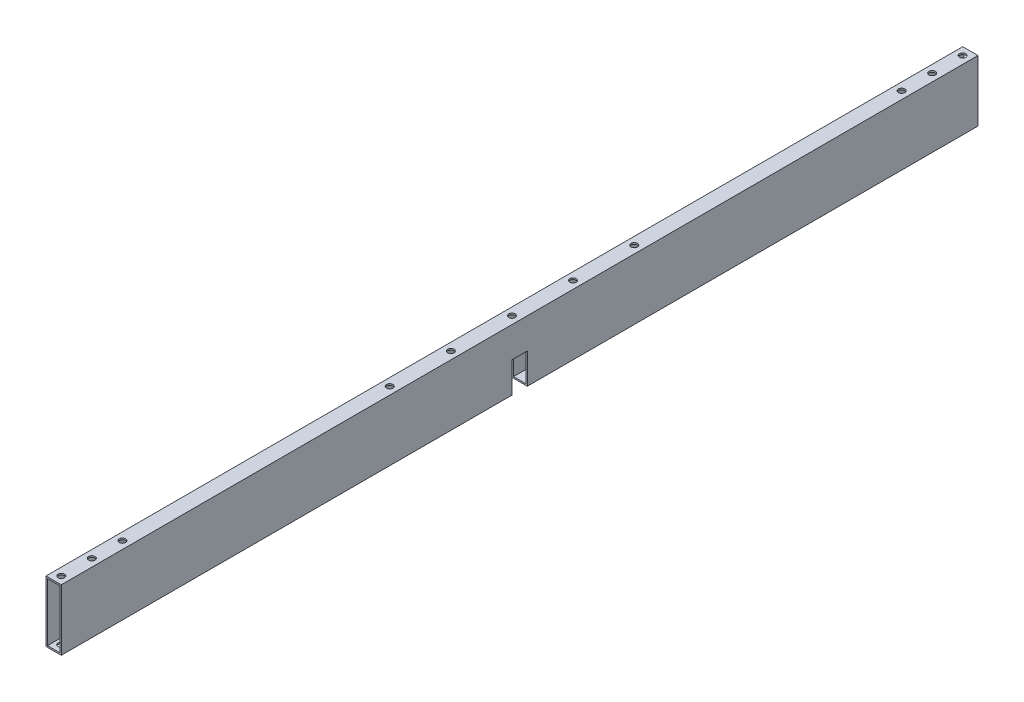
SolidWorks part; units mm, degrees
ref_plane "前视基准面" through (0, 0, 0) normal (0, 0, 1) x (1, 0, 0)
ref_plane "上视基准面" through (0, 0, 0) normal (0, 1, 0) x (1, 0, 0)
ref_plane "右视基准面" through (0, 0, 0) normal (1, 0, 0) x (0, 0, -1)
other "Configuration Table"
sketch "草图1" plane through (0, 0, 0) normal (0, 0, 1) x (1, 0, 0)
  line L1 (-4, -19) -> (4, -19)
  line L2 (-4, -19) -> (-4, 19)
  line L3 (-4, 19) -> (4, 19)
  line L4 (4, -19) -> (4, 19)
  line L5 (-4, -19) -> (4, 19) construction
  line L6 (-4, 19) -> (4, -19) construction
  line L7 (-5, -20) -> (5, -20)
  line L8 (-5, -20) -> (-5, 20)
  line L9 (-5, 20) -> (5, 20)
  line L10 (5, -20) -> (5, 20)
  line L11 (-5, -20) -> (5, 20) construction
  line L12 (-5, 20) -> (5, -20) construction
  point P0 (0, 0)
  point P6 (0, 0)
  dimension "D1" = 40
  dimension "D2" = 10
  dimension "D3" = 1
  dimension "D4" = 1
extrude "凸台-拉伸1" add sketch "草图1" along normal mid plane 600
sketch "草图2" plane through (0, 20, 0) normal (0, 1, 0) x (1, 0, 0)
  line L0 (0, 295) -> (0, 275) construction
  line L1 (5, -300) -> (5, 300) construction
  line L2 (5, 300) -> (-5, 300) construction
  circle A0 centre (0, 295) radius 2.1
  circle A1 centre (0, 275) radius 2.1
  circle A2 centre (0, 255) radius 2.1
  dimension "D5" = 4.2
  dimension "D2" = 20
  dimension "D3" = 5
  dimension "D4" = 5
  dimension "D1" = 3
extrude "切除-拉伸1" cut sketch "草图2" against normal through all
sketch "草图3" plane through (5, 0, 0) normal (1, 0, 0) x (0, 0, -1)
  line L0 (-300, -20) -> (300, -20) construction
  line L1 (-5, -20) -> (5, -20)
  line L2 (-5, -20) -> (-5, 0)
  line L3 (-5, 0) -> (5, 0)
  line L4 (5, -20) -> (5, 0)
  dimension "D1" = 10
  dimension "D2" = 5
extrude "切除-拉伸2" cut sketch "草图3" against normal through all
mirror "镜向1" about plane through (0, 0, 0) normal (0, 0, 1) of "切除-拉伸1"
sketch "草图4" plane through (0, 20, 0) normal (0, 1, 0) x (1, 0, 0)
  line L0 (0, -80) -> (0, -40) construction
  circle A0 centre (0, -80) radius 2.1
  circle A1 centre (0, -40) radius 2.1
  circle A2 centre (0, 0) radius 2.1
  circle A3 centre (0, 40) radius 2.1
  circle A4 centre (0, 80) radius 2.1
  point P3 (0, 0)
  point P5 (0, 0)
  point P13 (-3.9678, -8.486)
  point P14 (0, 0)
  dimension "D3" = 4.2
  dimension "D2" = 40
  dimension "D1" = 5
extrude "切除-拉伸3" cut sketch "草图4" against normal through all
